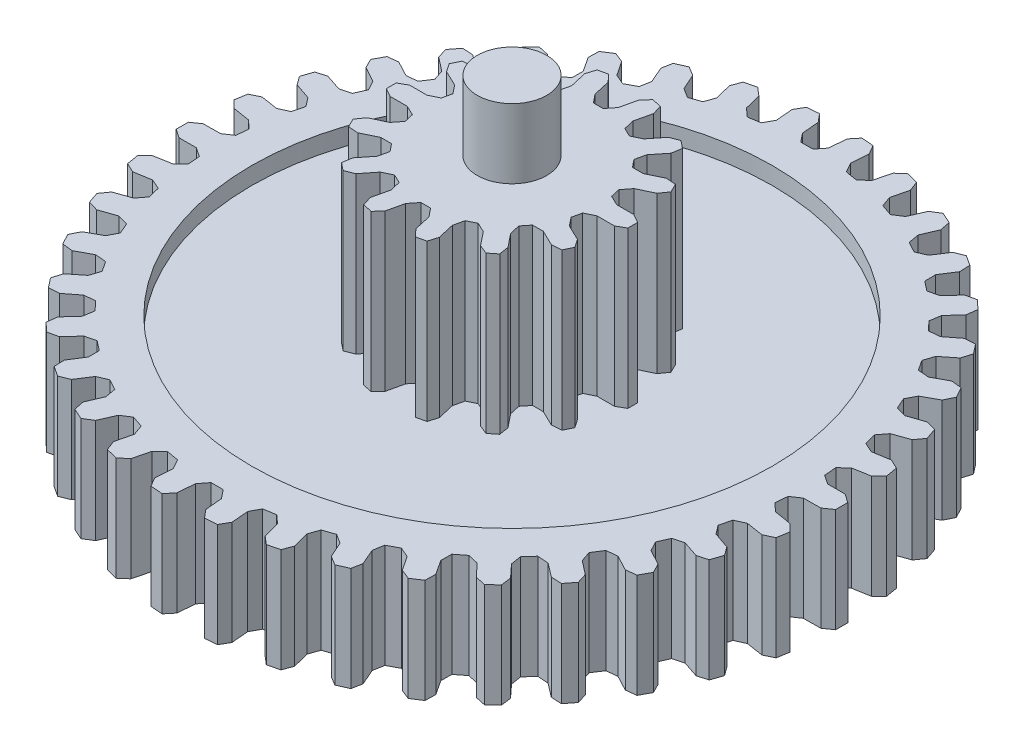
SolidWorks part; units mm, degrees
ref_plane "Front" through (0, 0, 0) normal (0, 0, 1) x (1, 0, 0)
ref_plane "Top" through (0, 0, 0) normal (0, 1, 0) x (1, 0, 0)
ref_plane "Right" through (0, 0, 0) normal (1, 0, 0) x (0, 0, -1)
sketch "Sketch1" plane through (0, 0, 0) normal (0, 0, 1) x (1, 0, 0)
  line L0 (0, -2.0723) -> (0, 9.4277)
  line L2 (1, 7.4277) -> (1, 9.4277)
  line L3 (3.5, 3.4277) -> (9.5, 3.4277)
  line L4 (9.5, 0.4277) -> (9.5, 3.4277)
  line L5 (1, 9.4277) -> (0, 9.4277)
  line L6 (8.391, 0.4277) -> (8.391, 0.9277)
  line L7 (1, 7.4277) -> (3.5, 7.4277)
  line L8 (3.5, 3.4277) -> (3.5, 7.4277)
  line L9 (8.391, 0.9277) -> (1.5, 0.9277)
  line L10 (1.5, 0.9277) -> (1.5, -0.0723)
  line L11 (1.5, -0.0723) -> (1, -0.0723)
  line L12 (1, -0.0723) -> (1, -1.0723)
  line L14 (8.391, 0.4277) -> (9.5, 0.4277)
  arc A0 (0, -2.0723) -> (1, -1.0723) centre (0, -1.0723) ccw
  dimension "D1" = 3
  dimension "D2" = 6
  dimension "D3" = 4
  dimension "D4" = 2
  dimension "D5" = 1
  dimension "D6" = 9.5
  dimension "D7" = 0.5
  dimension "D8" = 1
  dimension "D9" = 0.5
  dimension "D10" = 1
  dimension "D11" = 2.5
  dimension "D12" = 1
  dimension "D13" = 2
revolve "Revolve1" add sketch "Sketch1" angle 360 about L0
sketch "Sketch2" plane through (0, 3.4277, 0) normal (0, 1, 0) x (-1, 0, 0)
  circle A0 centre (0, 0) radius 3.5
  circle A1 centre (0, 0) radius 7.5
  dimension "D1" = 15
  dimension "D2" = 7
extrude "Cut-Extrude1" cut sketch "Sketch2" against normal blind 0.5
sketch "Sketch3" plane through (0, 3.4277, 0) normal (0, 1, 0) x (-1, 0, 0)
  line L0 (2.1568, 9.2453) -> (1.9273, 9.0458)
  line L1 (1.9273, 9.0458) -> (1.8053, 8.5613)
  line L2 (1.8053, 8.5613) -> (1.5711, 8.348)
  line L3 (1.5711, 8.348) -> (1.2246, 8.4058)
  line L4 (1.2246, 8.4058) -> (1.0699, 8.6838)
  line L5 (1.0699, 8.6838) -> (1.1068, 9.1821)
  line L6 (1.1068, 9.1821) -> (0.9521, 9.4455)
  line L7 (0.9521, 9.4455) -> (0.6057, 9.4742)
  line L8 (0.6057, 9.4742) -> (0.4122, 9.2396)
  line L9 (0.4122, 9.2396) -> (0.3716, 8.7417)
  line L10 (0.3716, 8.7417) -> (0.1756, 8.4927)
  line L11 (0.1756, 8.4927) -> (-0.1756, 8.4927)
  line L12 (-0.1756, 8.4927) -> (-0.3741, 8.7415)
  line L13 (-0.3741, 8.7415) -> (-0.4196, 9.239)
  line L14 (-0.4196, 9.239) -> (-0.6156, 9.4734)
  line L15 (-0.6156, 9.4734) -> (-0.962, 9.4447)
  line L16 (3.6491, 8.7642) -> (3.3899, 8.6052)
  line L17 (3.3899, 8.6052) -> (3.1899, 8.1474)
  line L18 (3.1899, 8.1474) -> (2.9237, 7.9756)
  line L19 (2.9237, 7.9756) -> (2.5915, 8.0896)
  line L20 (2.5915, 8.0896) -> (2.4846, 8.3893)
  line L21 (2.4846, 8.3893) -> (2.603, 8.8747)
  line L22 (2.603, 8.8747) -> (2.4937, 9.16)
  line L23 (2.4937, 9.16) -> (2.1568, 9.2453)
  line L24 (5.0419, 8.0441) -> (4.7601, 7.9298)
  line L25 (4.7601, 7.9298) -> (4.4874, 7.5113)
  line L26 (4.4874, 7.5113) -> (4.1966, 7.3855)
  line L27 (4.1966, 7.3855) -> (3.8876, 7.5527)
  line L28 (3.8876, 7.5527) -> (3.8315, 7.8659)
  line L29 (3.8315, 7.8659) -> (4.0282, 8.3252)
  line L30 (4.0282, 8.3252) -> (3.9674, 8.6246)
  line L31 (3.9674, 8.6246) -> (3.6491, 8.7642)
  line L32 (6.2971, 7.1045) -> (6.0003, 7.0382)
  line L33 (6.0003, 7.0382) -> (5.6625, 6.6702)
  line L34 (5.6625, 6.6702) -> (5.3549, 6.5941)
  line L35 (5.3549, 6.5941) -> (5.0778, 6.8098)
  line L36 (5.0778, 6.8098) -> (5.074, 7.128)
  line L37 (5.074, 7.128) -> (5.3436, 7.5486)
  line L38 (5.3436, 7.5486) -> (5.3329, 7.854)
  line L39 (5.3329, 7.854) -> (5.0419, 8.0441)
  line L40 (7.3806, 5.9711) -> (7.077, 5.9546)
  line L41 (7.077, 5.9546) -> (6.6831, 5.6472)
  line L42 (6.6831, 5.6472) -> (6.3673, 5.6228)
  line L43 (6.3673, 5.6228) -> (6.1294, 5.8812)
  line L44 (6.1294, 5.8812) -> (6.178, 6.1957)
  line L45 (6.178, 6.1957) -> (6.5131, 6.5661)
  line L46 (6.5131, 6.5661) -> (6.5529, 6.8691)
  line L47 (6.5529, 6.8691) -> (6.2971, 7.1045)
  line L48 (8.2628, 4.6749) -> (7.9605, 4.7086)
  line L49 (7.9605, 4.7086) -> (7.5215, 4.4702)
  line L50 (7.5215, 4.4702) -> (7.2059, 4.4981)
  line L51 (7.2059, 4.4981) -> (7.0138, 4.7921)
  line L52 (7.0138, 4.7921) -> (7.1135, 5.0943)
  line L53 (7.1135, 5.0943) -> (7.5051, 5.4046)
  line L54 (7.5051, 5.4046) -> (7.5941, 5.6968)
  line L55 (7.5941, 5.6968) -> (7.3806, 5.9711)
  line L56 (8.9195, 3.2511) -> (8.627, 3.3341)
  line L57 (8.627, 3.3341) -> (8.1547, 3.1712)
  line L58 (8.1547, 3.1712) -> (7.848, 3.2507)
  line L59 (7.848, 3.2507) -> (7.7069, 3.5723)
  line L60 (7.7069, 3.5723) -> (7.855, 3.854)
  line L61 (7.855, 3.854) -> (8.2923, 4.0955)
  line L62 (8.2923, 4.0955) -> (8.4282, 4.3692)
  line L63 (8.4282, 4.3692) -> (8.2628, 4.6749)
  line L64 (9.333, 1.7387) -> (9.0581, 1.8687)
  line L65 (9.0581, 1.8687) -> (8.5654, 1.7858)
  line L66 (8.5654, 1.7858) -> (8.276, 1.9146)
  line L67 (8.276, 1.9146) -> (8.1897, 2.2551)
  line L68 (8.1897, 2.2551) -> (8.3822, 2.5085)
  line L69 (8.3822, 2.5085) -> (8.8533, 2.6748)
  line L70 (8.8533, 2.6748) -> (9.0324, 2.9224)
  line L71 (9.0324, 2.9224) -> (8.9195, 3.2511)
  line L72 (9.4919, 0.1788) -> (9.2421, 0.3523)
  line L73 (9.2421, 0.3523) -> (8.7425, 0.3516)
  line L74 (8.7425, 0.3516) -> (8.4782, 0.5263)
  line L75 (8.4782, 0.5263) -> (8.4492, 0.8764)
  line L76 (8.4492, 0.8764) -> (8.6807, 1.0946)
  line L77 (8.6807, 1.0946) -> (9.1728, 1.1811)
  line L78 (9.1728, 1.1811) -> (9.3902, 1.3958)
  line L79 (9.3902, 1.3958) -> (9.333, 1.7387)
  line L80 (9.3919, -1.386) -> (9.174, -1.1737)
  line L81 (9.174, -1.1737) -> (8.6812, -1.0922)
  line L82 (8.6812, -1.0922) -> (8.4492, -0.8764)
  line L83 (8.4492, -0.8764) -> (8.4782, -0.5263)
  line L84 (8.4782, -0.5263) -> (8.7425, -0.3491)
  line L85 (8.7425, -0.3491) -> (9.2421, -0.3448)
  line L86 (9.2421, -0.3448) -> (9.4919, -0.1688)
  line L87 (9.4919, -0.1688) -> (9.4919, 0.1788)
  line L88 (9.0356, -2.9129) -> (8.8557, -2.6677)
  line L89 (8.8557, -2.6677) -> (8.383, -2.5062)
  line L90 (8.383, -2.5062) -> (8.1897, -2.2551)
  line L91 (8.1897, -2.2551) -> (8.276, -1.9146)
  line L92 (8.276, -1.9146) -> (8.5658, -1.7833)
  line L93 (8.5658, -1.7833) -> (9.0593, -1.8613)
  line L94 (9.0593, -1.8613) -> (9.3346, -1.7288)
  line L95 (9.3346, -1.7288) -> (9.3919, -1.386)
  line L96 (8.433, -4.3604) -> (8.2958, -4.089)
  line L97 (8.2958, -4.089) -> (7.8562, -3.8518)
  line L98 (7.8562, -3.8518) -> (7.7069, -3.5723)
  line L99 (7.7069, -3.5723) -> (7.848, -3.2507)
  line L100 (7.848, -3.2507) -> (8.1555, -3.1689)
  line L101 (8.1555, -3.1689) -> (8.6294, -3.327)
  line L102 (8.6294, -3.327) -> (8.9228, -3.2417)
  line L103 (8.9228, -3.2417) -> (9.0356, -2.9129)
  line L104 (7.6002, -5.6889) -> (7.5097, -5.3986)
  line L105 (7.5097, -5.3986) -> (7.115, -5.0923)
  line L106 (7.115, -5.0923) -> (7.0138, -4.7921)
  line L107 (7.0138, -4.7921) -> (7.2059, -4.4981)
  line L108 (7.2059, -4.4981) -> (7.5227, -4.468)
  line L109 (7.5227, -4.468) -> (7.9641, -4.702)
  line L110 (7.9641, -4.702) -> (8.2675, -4.6661)
  line L111 (8.2675, -4.6661) -> (8.433, -4.3604)
  line L112 (6.5602, -6.8623) -> (6.5187, -6.5611)
  line L113 (6.5187, -6.5611) -> (6.1798, -6.194)
  line L114 (6.1798, -6.194) -> (6.1294, -5.8812)
  line L115 (6.1294, -5.8812) -> (6.3673, -5.6228)
  line L116 (6.3673, -5.6228) -> (6.6847, -5.6453)
  line L117 (6.6847, -5.6453) -> (7.0816, -5.9487)
  line L118 (7.0816, -5.9487) -> (7.3868, -5.9632)
  line L119 (7.3868, -5.9632) -> (7.6002, -5.6889)
  line L120 (5.3412, -7.8485) -> (5.3498, -7.5445)
  line L121 (5.3498, -7.5445) -> (5.0761, -7.1266)
  line L122 (5.0761, -7.1266) -> (5.0778, -6.8098)
  line L123 (5.0778, -6.8098) -> (5.3549, -6.5941)
  line L124 (5.3549, -6.5941) -> (5.6643, -6.6685)
  line L125 (5.6643, -6.6685) -> (6.0059, -7.0331)
  line L126 (6.0059, -7.0331) -> (6.3045, -7.0977)
  line L127 (6.3045, -7.0977) -> (6.5602, -6.8623)
  line L128 (3.9766, -8.6206) -> (4.0351, -8.3222)
  line L129 (4.0351, -8.3222) -> (3.8338, -7.8649)
  line L130 (3.8338, -7.8649) -> (3.8876, -7.5527)
  line L131 (3.8876, -7.5527) -> (4.1966, -7.3855)
  line L132 (4.1966, -7.3855) -> (4.4895, -7.5099)
  line L133 (4.4895, -7.5099) -> (4.7663, -7.9257)
  line L134 (4.7663, -7.9257) -> (5.0503, -8.0386)
  line L135 (5.0503, -8.0386) -> (5.3412, -7.8485)
  line L136 (2.5034, -9.1575) -> (2.6103, -8.8728)
  line L137 (2.6103, -8.8728) -> (2.487, -8.3887)
  line L138 (2.487, -8.3887) -> (2.5915, -8.0896)
  line L139 (2.5915, -8.0896) -> (2.9237, -7.9756)
  line L140 (2.9237, -7.9756) -> (3.1921, -8.1464)
  line L141 (3.1921, -8.1464) -> (3.3968, -8.6022)
  line L142 (3.3968, -8.6022) -> (3.6583, -8.7602)
  line L143 (3.6583, -8.7602) -> (3.9766, -8.6206)
  line L144 (0.962, -9.4447) -> (1.1143, -9.1814)
  line L145 (1.1143, -9.1814) -> (1.0723, -8.6836)
  line L146 (1.0723, -8.6836) -> (1.2246, -8.4058)
  line L147 (1.2246, -8.4058) -> (1.5711, -8.348)
  line L148 (1.5711, -8.348) -> (1.8078, -8.5607)
  line L149 (1.8078, -8.5607) -> (1.9346, -9.0439)
  line L150 (1.9346, -9.0439) -> (2.1665, -9.2429)
  line L151 (2.1665, -9.2429) -> (2.5034, -9.1575)
  line L152 (-0.6057, -9.4742) -> (-0.4122, -9.2396)
  line L153 (-0.4122, -9.2396) -> (-0.3716, -8.7417)
  line L154 (-0.3716, -8.7417) -> (-0.1756, -8.4927)
  line L155 (-0.1756, -8.4927) -> (0.1756, -8.4927)
  line L156 (0.1756, -8.4927) -> (0.3741, -8.7415)
  line L157 (0.3741, -8.7415) -> (0.4196, -9.239)
  line L158 (0.4196, -9.239) -> (0.6156, -9.4734)
  line L159 (0.6156, -9.4734) -> (0.962, -9.4447)
  line L160 (-2.1568, -9.2453) -> (-1.9273, -9.0458)
  line L161 (-1.9273, -9.0458) -> (-1.8053, -8.5613)
  line L162 (-1.8053, -8.5613) -> (-1.5711, -8.348)
  line L163 (-1.5711, -8.348) -> (-1.2246, -8.4058)
  line L164 (-1.2246, -8.4058) -> (-1.0699, -8.6838)
  line L165 (-1.0699, -8.6838) -> (-1.1068, -9.1821)
  line L166 (-1.1068, -9.1821) -> (-0.9521, -9.4455)
  line L167 (-0.9521, -9.4455) -> (-0.6057, -9.4742)
  line L168 (-3.6491, -8.7642) -> (-3.3899, -8.6052)
  line L169 (-3.3899, -8.6052) -> (-3.1899, -8.1474)
  line L170 (-3.1899, -8.1474) -> (-2.9237, -7.9756)
  line L171 (-2.9237, -7.9756) -> (-2.5915, -8.0896)
  line L172 (-2.5915, -8.0896) -> (-2.4846, -8.3893)
  line L173 (-2.4846, -8.3893) -> (-2.603, -8.8747)
  line L174 (-2.603, -8.8747) -> (-2.4937, -9.16)
  line L175 (-2.4937, -9.16) -> (-2.1568, -9.2453)
  line L176 (-5.0419, -8.0441) -> (-4.7601, -7.9298)
  line L177 (-4.7601, -7.9298) -> (-4.4874, -7.5113)
  line L178 (-4.4874, -7.5113) -> (-4.1966, -7.3855)
  line L179 (-4.1966, -7.3855) -> (-3.8876, -7.5527)
  line L180 (-3.8876, -7.5527) -> (-3.8315, -7.8659)
  line L181 (-3.8315, -7.8659) -> (-4.0282, -8.3252)
  line L182 (-4.0282, -8.3252) -> (-3.9674, -8.6246)
  line L183 (-3.9674, -8.6246) -> (-3.6491, -8.7642)
  line L184 (-6.2971, -7.1045) -> (-6.0003, -7.0382)
  line L185 (-6.0003, -7.0382) -> (-5.6625, -6.6702)
  line L186 (-5.6625, -6.6702) -> (-5.3549, -6.5941)
  line L187 (-5.3549, -6.5941) -> (-5.0778, -6.8098)
  line L188 (-5.0778, -6.8098) -> (-5.074, -7.128)
  line L189 (-5.074, -7.128) -> (-5.3436, -7.5486)
  line L190 (-5.3436, -7.5486) -> (-5.3329, -7.854)
  line L191 (-5.3329, -7.854) -> (-5.0419, -8.0441)
  line L192 (-7.3806, -5.9711) -> (-7.077, -5.9546)
  line L193 (-7.077, -5.9546) -> (-6.6831, -5.6472)
  line L194 (-6.6831, -5.6472) -> (-6.3673, -5.6228)
  line L195 (-6.3673, -5.6228) -> (-6.1294, -5.8812)
  line L196 (-6.1294, -5.8812) -> (-6.178, -6.1957)
  line L197 (-6.178, -6.1957) -> (-6.5131, -6.5661)
  line L198 (-6.5131, -6.5661) -> (-6.5529, -6.8691)
  line L199 (-6.5529, -6.8691) -> (-6.2971, -7.1045)
  line L200 (-8.2628, -4.6749) -> (-7.9605, -4.7086)
  line L201 (-7.9605, -4.7086) -> (-7.5215, -4.4702)
  line L202 (-7.5215, -4.4702) -> (-7.2059, -4.4981)
  line L203 (-7.2059, -4.4981) -> (-7.0138, -4.7921)
  line L204 (-7.0138, -4.7921) -> (-7.1135, -5.0943)
  line L205 (-7.1135, -5.0943) -> (-7.5051, -5.4046)
  line L206 (-7.5051, -5.4046) -> (-7.5941, -5.6968)
  line L207 (-7.5941, -5.6968) -> (-7.3806, -5.9711)
  line L208 (-8.9195, -3.2511) -> (-8.627, -3.3341)
  line L209 (-8.627, -3.3341) -> (-8.1547, -3.1712)
  line L210 (-8.1547, -3.1712) -> (-7.848, -3.2507)
  line L211 (-7.848, -3.2507) -> (-7.7069, -3.5723)
  line L212 (-7.7069, -3.5723) -> (-7.855, -3.854)
  line L213 (-7.855, -3.854) -> (-8.2923, -4.0955)
  line L214 (-8.2923, -4.0955) -> (-8.4282, -4.3692)
  line L215 (-8.4282, -4.3692) -> (-8.2628, -4.6749)
  line L216 (-9.333, -1.7387) -> (-9.0581, -1.8687)
  line L217 (-9.0581, -1.8687) -> (-8.5654, -1.7858)
  line L218 (-8.5654, -1.7858) -> (-8.276, -1.9146)
  line L219 (-8.276, -1.9146) -> (-8.1897, -2.2551)
  line L220 (-8.1897, -2.2551) -> (-8.3822, -2.5085)
  line L221 (-8.3822, -2.5085) -> (-8.8533, -2.6748)
  line L222 (-8.8533, -2.6748) -> (-9.0324, -2.9224)
  line L223 (-9.0324, -2.9224) -> (-8.9195, -3.2511)
  line L224 (-9.4919, -0.1788) -> (-9.2421, -0.3523)
  line L225 (-9.2421, -0.3523) -> (-8.7425, -0.3516)
  line L226 (-8.7425, -0.3516) -> (-8.4782, -0.5263)
  line L227 (-8.4782, -0.5263) -> (-8.4492, -0.8764)
  line L228 (-8.4492, -0.8764) -> (-8.6807, -1.0946)
  line L229 (-8.6807, -1.0946) -> (-9.1728, -1.1811)
  line L230 (-9.1728, -1.1811) -> (-9.3902, -1.3958)
  line L231 (-9.3902, -1.3958) -> (-9.333, -1.7387)
  line L232 (-9.3919, 1.386) -> (-9.174, 1.1737)
  line L233 (-9.174, 1.1737) -> (-8.6812, 1.0922)
  line L234 (-8.6812, 1.0922) -> (-8.4492, 0.8764)
  line L235 (-8.4492, 0.8764) -> (-8.4782, 0.5263)
  line L236 (-8.4782, 0.5263) -> (-8.7425, 0.3491)
  line L237 (-8.7425, 0.3491) -> (-9.2421, 0.3448)
  line L238 (-9.2421, 0.3448) -> (-9.4919, 0.1688)
  line L239 (-9.4919, 0.1688) -> (-9.4919, -0.1788)
  line L240 (-9.0356, 2.9129) -> (-8.8557, 2.6677)
  line L241 (-8.8557, 2.6677) -> (-8.383, 2.5062)
  line L242 (-8.383, 2.5062) -> (-8.1897, 2.2551)
  line L243 (-8.1897, 2.2551) -> (-8.276, 1.9146)
  line L244 (-8.276, 1.9146) -> (-8.5658, 1.7833)
  line L245 (-8.5658, 1.7833) -> (-9.0593, 1.8613)
  line L246 (-9.0593, 1.8613) -> (-9.3346, 1.7288)
  line L247 (-9.3346, 1.7288) -> (-9.3919, 1.386)
  line L248 (-8.433, 4.3604) -> (-8.2958, 4.089)
  line L249 (-8.2958, 4.089) -> (-7.8562, 3.8518)
  line L250 (-7.8562, 3.8518) -> (-7.7069, 3.5723)
  line L251 (-7.7069, 3.5723) -> (-7.848, 3.2507)
  line L252 (-7.848, 3.2507) -> (-8.1555, 3.1689)
  line L253 (-8.1555, 3.1689) -> (-8.6294, 3.327)
  line L254 (-8.6294, 3.327) -> (-8.9228, 3.2417)
  line L255 (-8.9228, 3.2417) -> (-9.0356, 2.9129)
  line L256 (-7.6002, 5.6889) -> (-7.5097, 5.3986)
  line L257 (-7.5097, 5.3986) -> (-7.115, 5.0923)
  line L258 (-7.115, 5.0923) -> (-7.0138, 4.7921)
  line L259 (-7.0138, 4.7921) -> (-7.2059, 4.4981)
  line L260 (-7.2059, 4.4981) -> (-7.5227, 4.468)
  line L261 (-7.5227, 4.468) -> (-7.9641, 4.702)
  line L262 (-7.9641, 4.702) -> (-8.2675, 4.6661)
  line L263 (-8.2675, 4.6661) -> (-8.433, 4.3604)
  line L264 (-6.5602, 6.8623) -> (-6.5187, 6.5611)
  line L265 (-6.5187, 6.5611) -> (-6.1798, 6.194)
  line L266 (-6.1798, 6.194) -> (-6.1294, 5.8812)
  line L267 (-6.1294, 5.8812) -> (-6.3673, 5.6228)
  line L268 (-6.3673, 5.6228) -> (-6.6847, 5.6453)
  line L269 (-6.6847, 5.6453) -> (-7.0816, 5.9487)
  line L270 (-7.0816, 5.9487) -> (-7.3868, 5.9632)
  line L271 (-7.3868, 5.9632) -> (-7.6002, 5.6889)
  line L272 (-5.3412, 7.8485) -> (-5.3498, 7.5445)
  line L273 (-5.3498, 7.5445) -> (-5.0761, 7.1266)
  line L274 (-5.0761, 7.1266) -> (-5.0778, 6.8098)
  line L275 (-5.0778, 6.8098) -> (-5.3549, 6.5941)
  line L276 (-5.3549, 6.5941) -> (-5.6643, 6.6685)
  line L277 (-5.6643, 6.6685) -> (-6.0059, 7.0331)
  line L278 (-6.0059, 7.0331) -> (-6.3045, 7.0977)
  line L279 (-6.3045, 7.0977) -> (-6.5602, 6.8623)
  line L280 (-3.9766, 8.6206) -> (-4.0351, 8.3222)
  line L281 (-4.0351, 8.3222) -> (-3.8338, 7.8649)
  line L282 (-3.8338, 7.8649) -> (-3.8876, 7.5527)
  line L283 (-3.8876, 7.5527) -> (-4.1966, 7.3855)
  line L284 (-4.1966, 7.3855) -> (-4.4895, 7.5099)
  line L285 (-4.4895, 7.5099) -> (-4.7663, 7.9257)
  line L286 (-4.7663, 7.9257) -> (-5.0503, 8.0386)
  line L287 (-5.0503, 8.0386) -> (-5.3412, 7.8485)
  line L288 (-2.5034, 9.1575) -> (-2.6103, 8.8728)
  line L289 (-2.6103, 8.8728) -> (-2.487, 8.3887)
  line L290 (-2.487, 8.3887) -> (-2.5915, 8.0896)
  line L291 (-2.5915, 8.0896) -> (-2.9237, 7.9756)
  line L292 (-2.9237, 7.9756) -> (-3.1921, 8.1464)
  line L293 (-3.1921, 8.1464) -> (-3.3968, 8.6022)
  line L294 (-3.3968, 8.6022) -> (-3.6583, 8.7602)
  line L295 (-3.6583, 8.7602) -> (-3.9766, 8.6206)
  line L296 (-0.962, 9.4447) -> (-1.1143, 9.1814)
  line L297 (-1.1143, 9.1814) -> (-1.0723, 8.6836)
  line L298 (-1.0723, 8.6836) -> (-1.2246, 8.4058)
  line L299 (-1.2246, 8.4058) -> (-1.5711, 8.348)
  line L300 (-1.5711, 8.348) -> (-1.8078, 8.5607)
  line L301 (-1.8078, 8.5607) -> (-1.9346, 9.0439)
  line L302 (-1.9346, 9.0439) -> (-2.1665, 9.2429)
  line L303 (-2.1665, 9.2429) -> (-2.5034, 9.1575)
  circle A0 centre (0, 0) radius 9.5
extrude "Cut-Extrude2" cut sketch "Sketch3" against normal through all
sketch "Sketch4" plane through (0, 7.4277, 0) normal (0, 1, 0) x (-1, 0, 0)
  line L0 (0.6365, 3.4222) -> (0.9113, 3.3594)
  line L1 (0.9113, 3.3594) -> (0.993, 3.086)
  line L2 (0.993, 3.086) -> (0.8815, 2.6018)
  line L3 (0.8815, 2.6018) -> (0.9518, 2.299)
  line L4 (0.9518, 2.299) -> (1.204, 2.1775)
  line L5 (1.204, 2.1775) -> (1.4846, 2.3113)
  line L6 (1.4846, 2.3113) -> (1.7936, 2.7004)
  line L7 (1.7936, 2.7004) -> (2.0583, 2.8071)
  line L8 (-0.9113, 3.3594) -> (-0.6365, 3.4222)
  line L9 (-0.6365, 3.4222) -> (-0.4443, 3.2112)
  line L10 (-0.4443, 3.2112) -> (-0.3347, 2.7266)
  line L11 (-0.3347, 2.7266) -> (-0.14, 2.4843)
  line L12 (-0.14, 2.4843) -> (0.14, 2.4843)
  line L13 (0.14, 2.4843) -> (0.3347, 2.7266)
  line L14 (0.3347, 2.7266) -> (0.4443, 3.2112)
  line L15 (0.4443, 3.2112) -> (0.6365, 3.4222)
  line L16 (2.0583, 2.8071) -> (2.2787, 2.6313)
  line L17 (2.2787, 2.6313) -> (2.2336, 2.3495)
  line L18 (2.2336, 2.3495) -> (1.923, 1.9617)
  line L19 (1.923, 1.9617) -> (1.855, 1.6583)
  line L20 (1.855, 1.6583) -> (2.0295, 1.4395)
  line L21 (2.0295, 1.4395) -> (2.3404, 1.4383)
  line L22 (2.3404, 1.4383) -> (2.7876, 1.6548)
  line L23 (2.7876, 1.6548) -> (3.0724, 1.636)
  line L24 (3.0724, 1.636) -> (3.1947, 1.3821)
  line L25 (3.1947, 1.3821) -> (3.0318, 1.1477)
  line L26 (3.0318, 1.1477) -> (2.5837, 0.933)
  line L27 (2.5837, 0.933) -> (2.3909, 0.6893)
  line L28 (2.3909, 0.6893) -> (2.4531, 0.4164)
  line L29 (2.4531, 0.4164) -> (2.7327, 0.2804)
  line L30 (2.7327, 0.2804) -> (3.2296, 0.2814)
  line L31 (3.2296, 0.2814) -> (3.478, 0.1409)
  line L32 (3.478, 0.1409) -> (3.478, -0.1409)
  line L33 (3.478, -0.1409) -> (3.2296, -0.2814)
  line L34 (3.2296, -0.2814) -> (2.7327, -0.2804)
  line L35 (2.7327, -0.2804) -> (2.4531, -0.4164)
  line L36 (2.4531, -0.4164) -> (2.3909, -0.6893)
  line L37 (2.3909, -0.6893) -> (2.5837, -0.933)
  line L38 (2.5837, -0.933) -> (3.0318, -1.1477)
  line L39 (3.0318, -1.1477) -> (3.1947, -1.3821)
  line L40 (3.1947, -1.3821) -> (3.0724, -1.636)
  line L41 (3.0724, -1.636) -> (2.7876, -1.6548)
  line L42 (2.7876, -1.6548) -> (2.3404, -1.4383)
  line L43 (2.3404, -1.4383) -> (2.0295, -1.4395)
  line L44 (2.0295, -1.4395) -> (1.855, -1.6583)
  line L45 (1.855, -1.6583) -> (1.923, -1.9617)
  line L46 (1.923, -1.9617) -> (2.2336, -2.3495)
  line L47 (2.2336, -2.3495) -> (2.2787, -2.6313)
  line L48 (2.2787, -2.6313) -> (2.0583, -2.8071)
  line L49 (2.0583, -2.8071) -> (1.7936, -2.7004)
  line L50 (1.7936, -2.7004) -> (1.4846, -2.3113)
  line L51 (1.4846, -2.3113) -> (1.204, -2.1775)
  line L52 (1.204, -2.1775) -> (0.9518, -2.299)
  line L53 (0.9518, -2.299) -> (0.8815, -2.6018)
  line L54 (0.8815, -2.6018) -> (0.993, -3.086)
  line L55 (0.993, -3.086) -> (0.9113, -3.3594)
  line L56 (0.9113, -3.3594) -> (0.6365, -3.4222)
  line L57 (0.6365, -3.4222) -> (0.4443, -3.2112)
  line L58 (0.4443, -3.2112) -> (0.3347, -2.7266)
  line L59 (0.3347, -2.7266) -> (0.14, -2.4843)
  line L60 (0.14, -2.4843) -> (-0.14, -2.4843)
  line L61 (-0.14, -2.4843) -> (-0.3347, -2.7266)
  line L62 (-0.3347, -2.7266) -> (-0.4443, -3.2112)
  line L63 (-0.4443, -3.2112) -> (-0.6365, -3.4222)
  line L64 (-0.6365, -3.4222) -> (-0.9113, -3.3594)
  line L65 (-0.9113, -3.3594) -> (-0.993, -3.086)
  line L66 (-0.993, -3.086) -> (-0.8815, -2.6018)
  line L67 (-0.8815, -2.6018) -> (-0.9518, -2.299)
  line L68 (-0.9518, -2.299) -> (-1.204, -2.1775)
  line L69 (-1.204, -2.1775) -> (-1.4846, -2.3113)
  line L70 (-1.4846, -2.3113) -> (-1.7936, -2.7004)
  line L71 (-1.7936, -2.7004) -> (-2.0583, -2.8071)
  line L72 (-2.0583, -2.8071) -> (-2.2787, -2.6313)
  line L73 (-2.2787, -2.6313) -> (-2.2336, -2.3495)
  line L74 (-2.2336, -2.3495) -> (-1.923, -1.9617)
  line L75 (-1.923, -1.9617) -> (-1.855, -1.6583)
  line L76 (-1.855, -1.6583) -> (-2.0295, -1.4395)
  line L77 (-2.0295, -1.4395) -> (-2.3404, -1.4383)
  line L78 (-2.3404, -1.4383) -> (-2.7876, -1.6548)
  line L79 (-2.7876, -1.6548) -> (-3.0724, -1.636)
  line L80 (-3.0724, -1.636) -> (-3.1947, -1.3821)
  line L81 (-3.1947, -1.3821) -> (-3.0318, -1.1477)
  line L82 (-3.0318, -1.1477) -> (-2.5837, -0.933)
  line L83 (-2.5837, -0.933) -> (-2.3909, -0.6893)
  line L84 (-2.3909, -0.6893) -> (-2.4531, -0.4164)
  line L85 (-2.4531, -0.4164) -> (-2.7327, -0.2804)
  line L86 (-2.7327, -0.2804) -> (-3.2296, -0.2814)
  line L87 (-3.2296, -0.2814) -> (-3.478, -0.1409)
  line L88 (-3.478, -0.1409) -> (-3.478, 0.1409)
  line L89 (-3.478, 0.1409) -> (-3.2296, 0.2814)
  line L90 (-3.2296, 0.2814) -> (-2.7327, 0.2804)
  line L91 (-2.7327, 0.2804) -> (-2.4531, 0.4164)
  line L92 (-2.4531, 0.4164) -> (-2.3909, 0.6893)
  line L93 (-2.3909, 0.6893) -> (-2.5837, 0.933)
  line L94 (-2.5837, 0.933) -> (-3.0318, 1.1477)
  line L95 (-3.0318, 1.1477) -> (-3.1947, 1.3821)
  line L96 (-3.1947, 1.3821) -> (-3.0724, 1.636)
  line L97 (-3.0724, 1.636) -> (-2.7876, 1.6548)
  line L98 (-2.7876, 1.6548) -> (-2.3404, 1.4383)
  line L99 (-2.3404, 1.4383) -> (-2.0295, 1.4395)
  line L100 (-2.0295, 1.4395) -> (-1.855, 1.6583)
  line L101 (-1.855, 1.6583) -> (-1.923, 1.9617)
  line L102 (-1.923, 1.9617) -> (-2.2336, 2.3495)
  line L103 (-2.2336, 2.3495) -> (-2.2787, 2.6313)
  line L104 (-2.2787, 2.6313) -> (-2.0583, 2.8071)
  line L105 (-2.0583, 2.8071) -> (-1.7936, 2.7004)
  line L106 (-1.7936, 2.7004) -> (-1.4846, 2.3113)
  line L107 (-1.4846, 2.3113) -> (-1.204, 2.1775)
  line L108 (-1.204, 2.1775) -> (-0.9518, 2.299)
  line L109 (-0.9518, 2.299) -> (-0.8815, 2.6018)
  line L110 (-0.8815, 2.6018) -> (-0.993, 3.086)
  line L111 (-0.993, 3.086) -> (-0.9113, 3.3594)
  circle A0 centre (0, 0) radius 3.5
extrude "Cut-Extrude3" cut sketch "Sketch4" against normal blind 4.5
